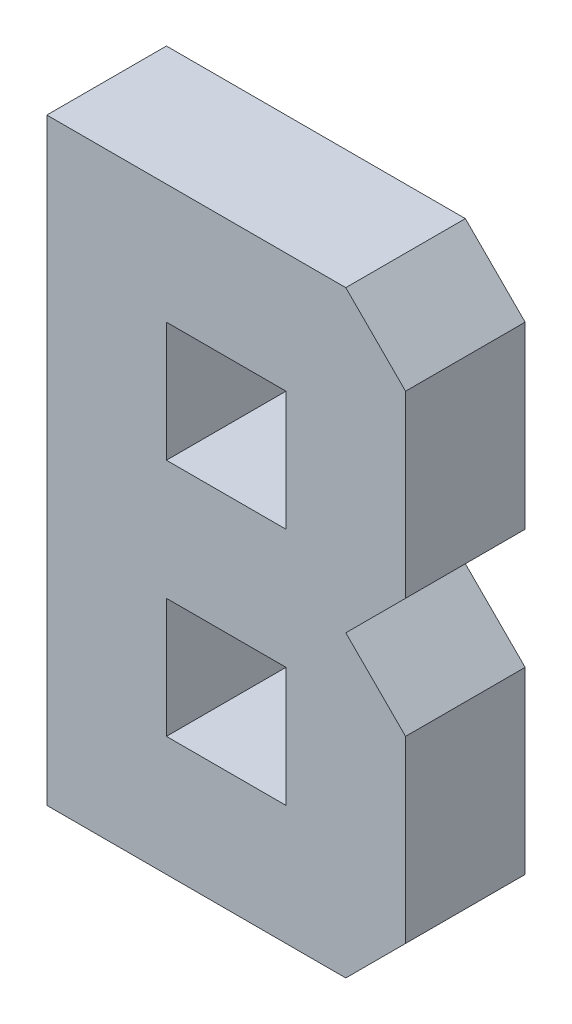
SolidWorks part; units mm, degrees
ref_plane "Plan de face" through (0, 0, 0) normal (0, 0, 1) x (1, 0, 0)
ref_plane "Plan de dessus" through (0, 0, 0) normal (0, 1, 0) x (1, 0, 0)
ref_plane "Plan de droite" through (0, 0, 0) normal (1, 0, 0) x (0, 0, -1)
sketch "Esquisse1" plane through (0, 0, 0) normal (0, 0, 1) x (1, 0, 0)
  line L0 (30, 30) -> (30, 50)
  line L1 (0, 0) -> (30, 0)
  line L2 (0, 0) -> (0, 50)
  line L3 (0, 50) -> (30, 50)
  line L4 (30, 0) -> (30, 20)
  line L5 (10, 40) -> (20, 40)
  line L6 (10, 40) -> (10, 30)
  line L7 (10, 30) -> (20, 30)
  line L8 (20, 40) -> (20, 30)
  line L9 (10, 20) -> (20, 20)
  line L10 (10, 20) -> (10, 10)
  line L11 (10, 10) -> (20, 10)
  line L12 (20, 20) -> (20, 10)
  line L13 (30, 30) -> (25, 30)
  line L15 (30, 20) -> (25, 20)
  line L16 (25, 30) -> (25, 20)
  dimension "D1" = 30
  dimension "D2" = 50
  dimension "D3" = 10
  dimension "D4" = 10
  dimension "D5" = 10
  dimension "D6" = 10
  dimension "D7" = 10
  dimension "D8" = 10
  dimension "D9" = 10
  dimension "D10" = 10
  dimension "D11" = 5
  dimension "D12" = 20
  dimension "D13" = 10
extrude "Boss.-Extru.1" add sketch "Esquisse1" along normal blind 10
chamfer "Chanfrein1" distance 5 angle 45 4 edges at (30, 50, 5) (30, 0, 5) (25, 30, 5) (25, 20, 5)
